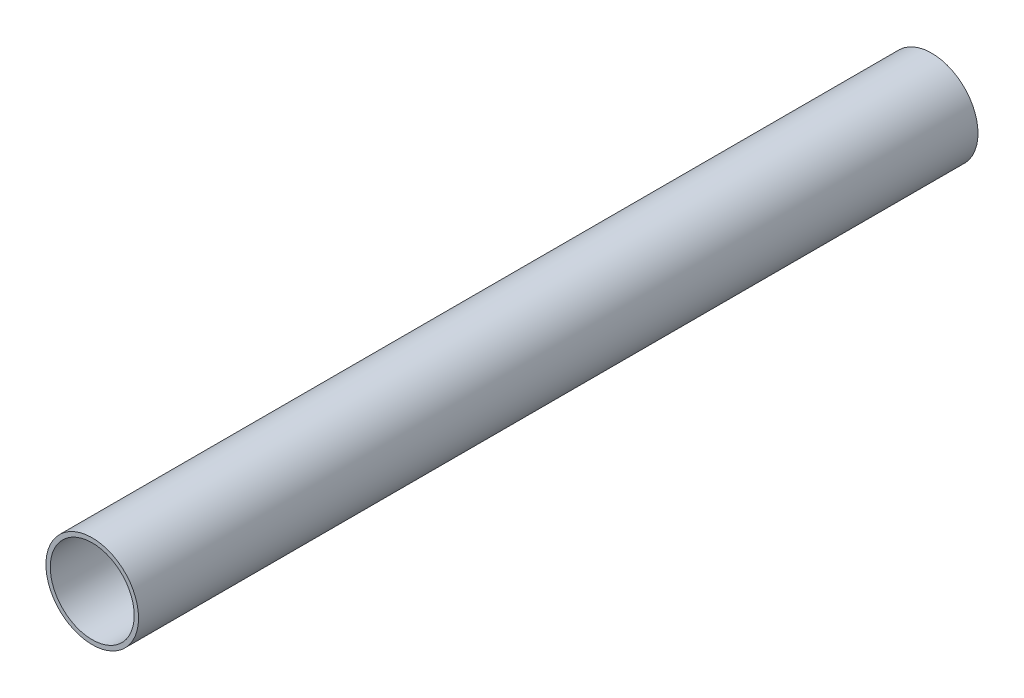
SolidWorks part; units mm, degrees
ref_plane "Front Plane" through (0, 0, 0) normal (0, 0, 1) x (1, 0, 0)
ref_plane "Top Plane" through (0, 0, 0) normal (0, 1, 0) x (1, 0, 0)
ref_plane "Right Plane" through (0, 0, 0) normal (1, 0, 0) x (0, 0, -1)
sketch "Sketch1" plane through (0, 0, 0) normal (0, 0, 1) x (1, 0, 0)
  circle A0 centre (0, 0) radius 8
  dimension "D1" = 16
extrude "Extrude1" add sketch "Sketch1" against normal blind 145
sketch "Sketch2" plane through (0, 0, 0) normal (0, 0, 1) x (1, 0, 0)
  circle A0 centre (0, 0) radius 7.25
  dimension "D1" = 14.5
extrude "Cut-Extrude1" cut sketch "Sketch2" against normal through all
